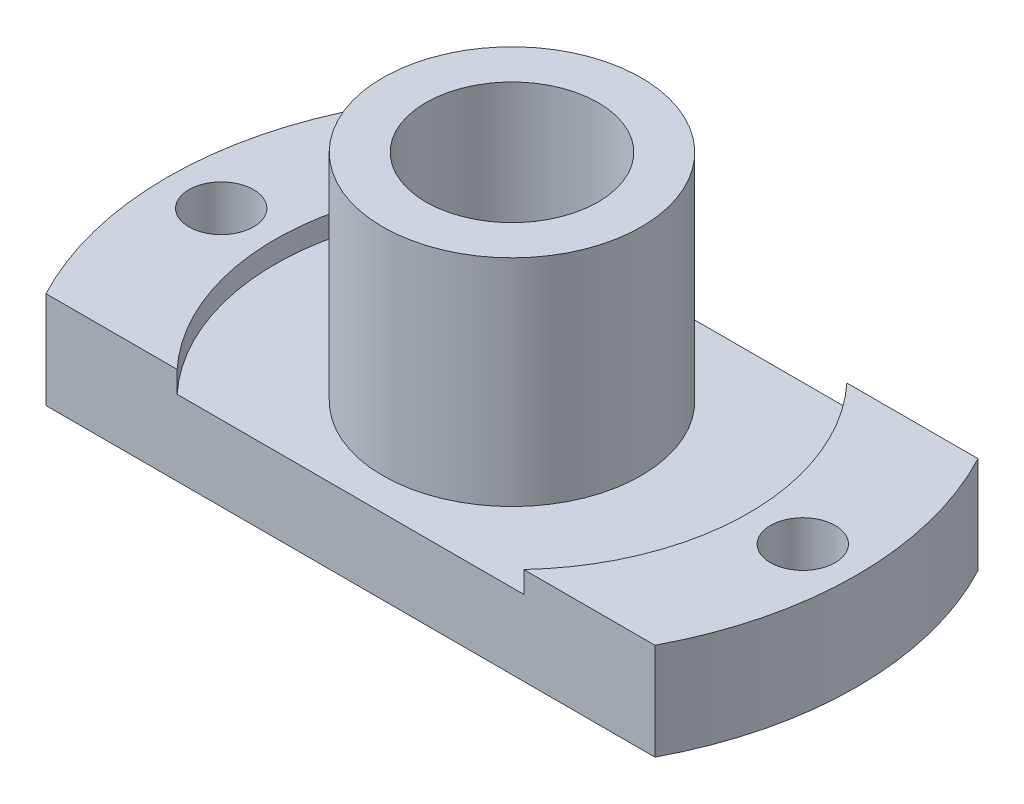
SolidWorks part; units mm, degrees
ref_plane "前视基准面" through (0, 0, 0) normal (0, 0, 1) x (1, 0, 0)
ref_plane "上视基准面" through (0, 0, 0) normal (0, 1, 0) x (1, 0, 0)
ref_plane "右视基准面" through (0, 0, 0) normal (1, 0, 0) x (0, 0, -1)
sketch "草图1" plane through (0, 0, 0) normal (0, 1, 0) x (1, 0, 0)
  circle A0 centre (0, 0) radius 12
  circle A1 centre (0, 0) radius 8
extrude "拉伸1" add sketch "草图1" along normal blind 27
sketch "草图2" plane through (0, 0, 0) normal (0, -1, 0) x (1, 0, 0)
  line L0 (-28.2666, -15) -> (28.2666, -15)
  line L1 (-28.2666, 15) -> (28.2666, 15)
  line L2 (0, 0) -> (0, 32.8412) construction
  arc A0 (28.2666, -15) -> (28.2666, 15) centre (0, 0) ccw
  arc A1 (-28.2666, -15) -> (-28.2666, 15) centre (0, 0) cw
  circle A2 centre (0, 0) radius 8
  point P3 (0, -15)
  point P10 (0, 15)
extrude "拉伸2" add sketch "草图2" against normal blind 7
sketch "草图3" plane through (0, 7, 0) normal (0, 1, 0) x (1, 0, 0)
  line L0 (28.2666, 15) -> (16.0935, 15)
  line L1 (-28.2666, 15) -> (28.2666, 15) construction
  line L2 (28.2666, -15) -> (16.0935, -15)
  line L3 (28.2666, -15) -> (-28.2666, -15) construction
  line L4 (0, 0) -> (0, 27.8638) construction
  line L5 (-28.2666, -15) -> (-16.0935, -15)
  line L6 (-28.2666, 15) -> (-16.0935, 15)
  arc A0 (28.2666, -15) -> (28.2666, 15) centre (0, 0) ccw
  arc A1 (16.0935, -15) -> (16.0935, 15) centre (0, 0) ccw
  arc A2 (-16.0935, -15) -> (-16.0935, 15) centre (0, 0) cw
  arc A3 (-28.2666, -15) -> (-28.2666, 15) centre (0, 0) cw
extrude "拉伸3" add sketch "草图3" along normal blind 2
sketch "草图4" plane through (0, 9, 0) normal (0, 1, 0) x (1, 0, 0)
  line L0 (0, 0) -> (0, 22.0211) construction
  circle A0 centre (27, 0) radius 3
  circle A1 centre (-27, 0) radius 3
extrude "切除-拉伸1" cut sketch "草图4" against normal through all
